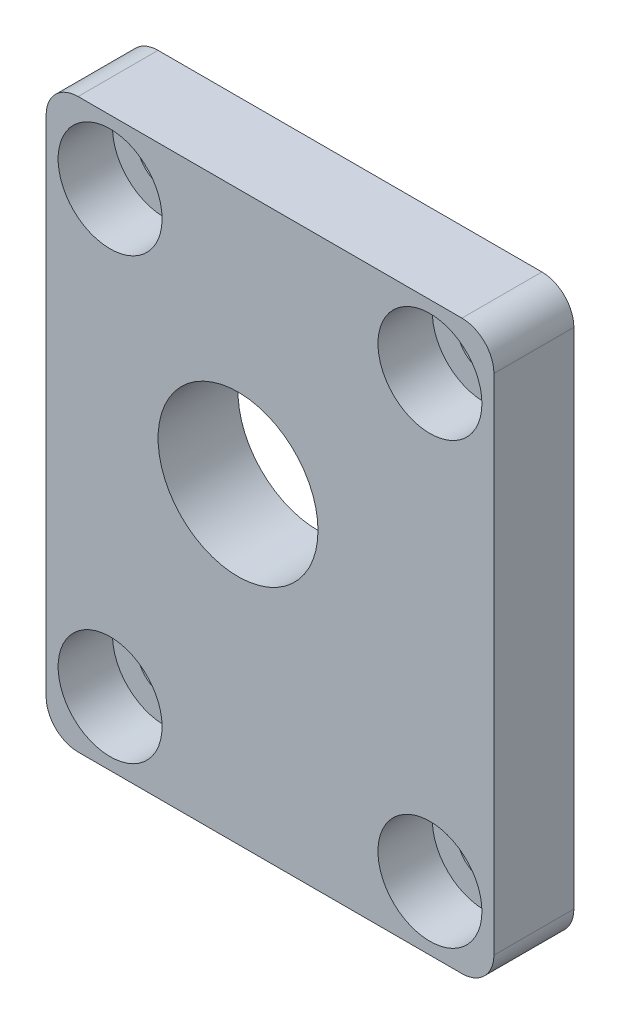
SolidWorks part; units mm, degrees
ref_plane "Ebene vorne" through (0, 0, 0) normal (0, 0, 1) x (1, 0, 0)
ref_plane "Ebene oben" through (0, 0, 0) normal (0, 1, 0) x (1, 0, 0)
ref_plane "Ebene rechts" through (0, 0, 0) normal (1, 0, 0) x (0, 0, -1)
sketch "Skizze1" plane through (0, 0, 0) normal (0, 0, 1) x (1, 0, 0)
  line L0 (-14, 0) -> (0, 0) construction
  line L1 (-14, -17.75) -> (14, -17.75)
  line L2 (-14, -17.75) -> (-14, 17.75)
  line L3 (-14, 17.75) -> (14, 17.75)
  line L4 (14, -17.75) -> (14, 17.75)
  line L5 (0, 0) -> (0, -17.75) construction
  circle A0 centre (-2, 1.75) radius 5
  point P0 (0, 0)
  dimension "D3" = 10
  dimension "D4" = 16
  dimension "D5" = 16
  dimension "D1" = 28
  dimension "D2" = 35.5
extrude "Aufsatz-Linear austragen1" add sketch "Skizze1" along normal blind 5
hole_wizard "Stirnsenkung für M3 Zylinderschraube mit Innensechskant1" positions "Skizze2" profile "Skizze3" counterbore size "M3" standard "DIN"
sketch "Skizze2" plane through (0, 0, 5) normal (0, 0, 1) x (1, 0, 0)
  line L0 (-14, 17.75) -> (-14, -17.75) construction
  line L1 (14, 17.75) -> (-14, 17.75) construction
  line L2 (-14, -17.75) -> (14, -17.75) construction
  line L3 (14, -17.75) -> (14, 17.75) construction
  point P0 (-10, 13.75)
  point P2 (10, 13.75)
  point P4 (10, -13.75)
  point P6 (-10, -13.75)
  dimension "D1" = 4
  dimension "D2" = 4
  dimension "D3" = 4
  dimension "D4" = 4
sketch "Skizze3" plane through (-10, 13.75, 5) normal (1, 0, 0) x (0, -1, 0)
  line L0 (0, 0) -> (0, 5)
  line L1 (0, 5) -> (1.7, 5)
  line L3 (1.7, 5) -> (1.7, 3.4)
  line L4 (1.7, 3.4) -> (3.25, 3.4)
  line L5 (3.25, 3.4) -> (3.25, 0)
  line L7 (3.25, 0) -> (0, 0)
  line L11 (0, -6.35) -> (0, 107.95) construction
  dimension "Bohrerdurchmesser" = 3.4
  dimension "Bohrungstiefe" = 5
  dimension "Senkdurchmesser2" = 6.5
  dimension "Senktiefe2" = 3.4
fillet "Verrundung1" radius 2 4 edges at (-14, -17.75, 2.5) (-14, 17.75, 2.5) (14, -17.75, 2.5) (14, 17.75, 2.5)
